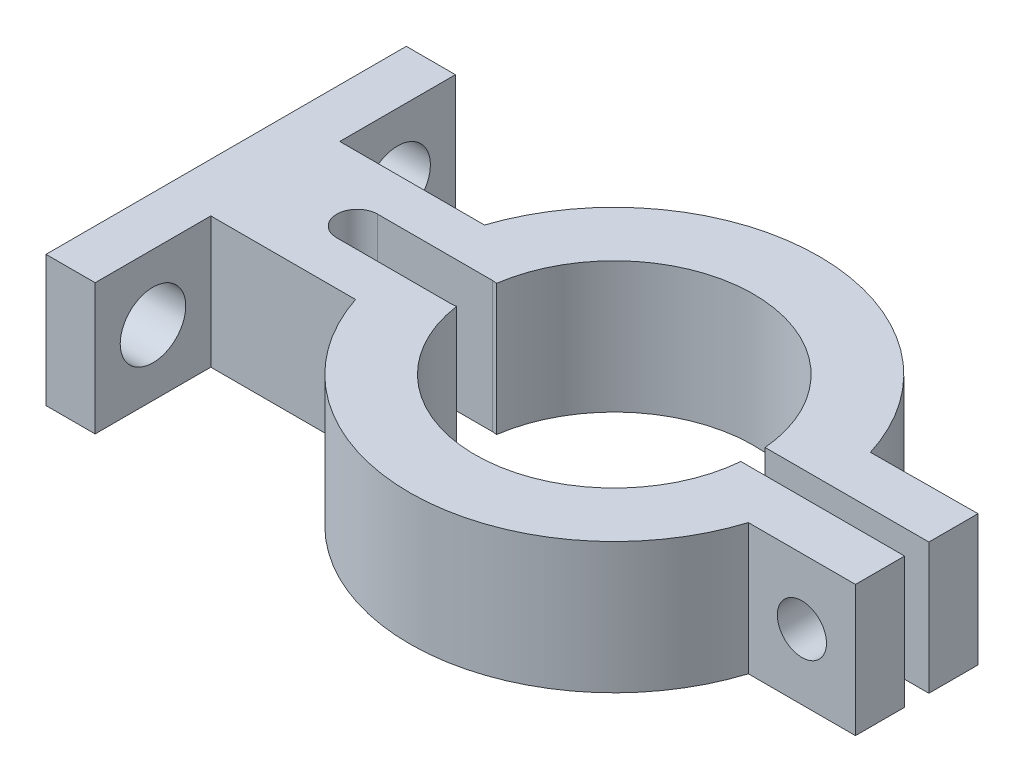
SolidWorks part; units mm, degrees
ref_plane "Front Plane" through (0, 0, 0) normal (0, 0, 1) x (1, 0, 0)
ref_plane "Top Plane" through (0, 0, 0) normal (0, 1, 0) x (1, 0, 0)
ref_plane "Right Plane" through (0, 0, 0) normal (1, 0, 0) x (0, 0, -1)
sketch "Sketch1" plane through (0, 0, 0) normal (0, 1, 0) x (1, 0, 0)
  line L1 (-4.5, -3.937) -> (4.3362, -3.937)
  line L2 (-7.5, -4) -> (-7.5, 4)
  line L3 (-4.5, 3.937) -> (4.3362, 3.937)
  line L5 (-7.5, 3.7583) -> (-7.5, 4)
  line L6 (-7.5, -4) -> (-7.5, -11)
  line L7 (16.2, 0) -> (16.2, -12.5) construction
  line L8 (-55, 0) -> (55, 0) construction
  line L10 (-1000.5, 0) -> (-7.5, 0) construction
  line L11 (24.6677, -0.7408) -> (34.6677, -0.7408)
  line L13 (28.1271, -3.7408) -> (34.6677, -3.7408)
  line L14 (34.6677, -0.7408) -> (34.6677, -3.7408)
  line L15 (28.1401, 3.6991) -> (34.6677, 3.7408)
  line L16 (34.6677, 0.7408) -> (34.6677, 3.7408)
  line L17 (24.6677, 0.7408) -> (34.6677, 0.7408)
  line L18 (7.5, 0) -> (42.9019, 0) construction
  line L19 (-7.5, -11) -> (-4.5, -11)
  line L20 (-4.5, -11) -> (-4.5, -3.937)
  line L21 (-4.5, 11) -> (-4.5, 3.937)
  line L22 (-7.5, 11) -> (-4.5, 11)
  line L23 (-7.5, 4) -> (-7.5, 11)
  arc A0 (28.1401, 3.6991) -> (4.3362, 3.937) centre (16.2, 0) ccw
  arc A1 (24.6677, 0.7408) -> (24.6677, -0.7408) centre (16.2, 0) ccw
  arc A2 (28.678, -0.7408) -> (28.678, 0.7408) centre (16.2, 0) ccw construction
  arc A3 (24.6677, -0.7408) -> (24.6677, 0.7408) centre (16.2, 0) ccw construction
  arc A4 (4.3362, -3.937) -> (28.1271, -3.7408) centre (16.2, 0) ccw
  point P0 (0, 0)
  dimension "D3" = 17
  dimension "D4" = 4
  dimension "D1" = 3
  dimension "D2" = 8
  dimension "D5" = 7
  dimension "D6" = 3
  dimension "D7" = 10
extrude "Boss-Extrude1" add sketch "Sketch1" along normal blind 8
sketch "Sketch2" plane through (-7.5, 0, 0) normal (-1, 0, 0) x (0, 0, 1)
  line L0 (-11, 8) -> (-3.937, 8) construction
  line L2 (-11, 8) -> (-3.937, 8)
  line L3 (-11, 8) -> (-11, 0) construction
  line L4 (0, -55) -> (0, 55) construction
  circle A0 centre (-7.4685, 4) radius 2
  circle A1 centre (7.4685, 4) radius 2
  point P9 (-7.4685, 8)
  point P12 (-11, 4)
  dimension "D1" = 4
extrude "Cut-Extrude2" cut sketch "Sketch2" against normal up to vertex (3 mm away) contours A1 | A0
sketch "Sketch4" plane through (0, 0, 3.7408) normal (0, 0, 1) x (1, 0, 0)
  line L1 (34.6677, 8) -> (34.6677, 0) construction
  line L2 (28.1271, 8) -> (34.6677, 8) construction
  circle A0 centre (31.3974, 4) radius 1.5
  point P6 (34.6677, 4)
  point P7 (31.3974, 8)
  dimension "D1" = 3
extrude "Cut-Extrude3" cut sketch "Sketch4" against normal through all
sketch "Sketch5" plane through (0, 8, 0) normal (0, 1, 0) x (1, 0, 0)
  line L0 (0.5, 0) -> (7.5, 0) construction
  line L1 (0.5, 1.25) -> (7.5, 1.25)
  line L2 (0.5, -1.25) -> (7.5, -1.25)
  line L4 (-7.5, -11) -> (-7.5, 11) construction
  arc A2 (24.6677, 0.7408) -> (24.6677, -0.7408) centre (16.2, 0) ccw construction
  arc A3 (0.5, 1.25) -> (0.5, -1.25) centre (0.5, 0) ccw
  arc A4 (7.5, -1.25) -> (7.5, 1.25) centre (7.5, 0) ccw
  point P5 (4, 0)
  point P13 (-7.5, 0)
  dimension "D1" = 7
extrude "Cut-Extrude4" cut sketch "Sketch5" against normal through all
